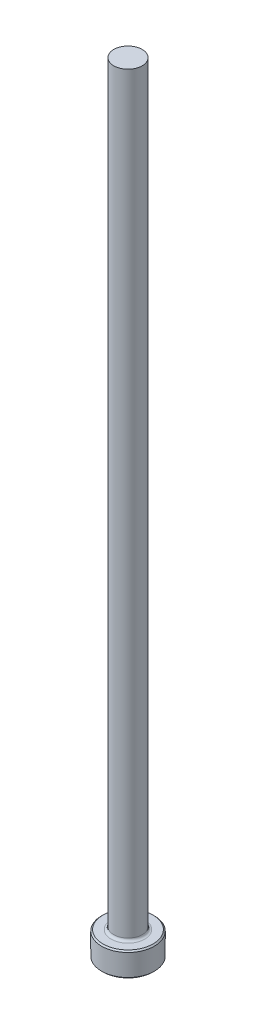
SolidWorks part; units mm, degrees
ref_plane "Front Plane" through (0, 0, 0) normal (0, 0, 1) x (1, 0, 0)
ref_plane "Top Plane" through (0, 0, 0) normal (0, 1, 0) x (1, 0, 0)
ref_plane "Right Plane" through (0, 0, 0) normal (1, 0, 0) x (0, 0, -1)
sketch "Sketch1" plane through (0, 0, 0) normal (0, 0, 1) x (1, 0, 0)
  line L0 (0, 259.9588) -> (0, -15.1925) construction
  line L1 (0, 0) -> (-5.1562, 0)
  line L2 (-5.1562, 0) -> (-5.1562, 4.7498)
  line L3 (-5.1562, 4.7498) -> (-2.7775, 4.7498)
  line L4 (-2.7775, 4.7498) -> (-2.7775, 152.4)
  line L5 (-2.7775, 152.4) -> (0, 152.4)
  line L6 (0, 152.4) -> (0, 0)
  dimension "L" = 152.4
  dimension "H" = 10.3124
  dimension "T" = 4.7498
  dimension "D" = 5.555
revolve "Revolve1" add sketch "Sketch1" angle 360 about L0
chamfer "Chamfer1" distance 0.254 angle 45 2 edges at (0, 4.7498, 5.1562) (0, 0, 5.1562)
fillet "Fillet1" radius 0.508 1 edges at (0, 4.7498, 2.7775)
sketch "Pocket Sketch" plane through (0, 0, 0) normal (0, 0, 1) x (1, 0, 0)
  line L0 (-5.5531, 0) -> (-5.5531, 4.7752)
  line L1 (-5.5531, 4.7752) -> (-3.7379, 4.7752)
  line L2 (-2.9759, 5.5372) -> (-2.9759, 22.225)
  line L3 (-2.9759, 22.225) -> (0, 22.225)
  line L4 (0, 22.225) -> (0, 0)
  line L5 (0, 0) -> (-5.5531, 0)
  line L6 (0, 12.6104) -> (0, -2.4989) construction
  line L7 (-5.1562, 4.4958) -> (-5.1562, 0.254) construction
  line L8 (4.9022, 4.7498) -> (-4.9022, 4.7498) construction
  line L9 (-2.7775, 152.4) -> (-2.7775, 5.2578) construction
  line L10 (-3.7379, 4.7752) -> (-2.9759, 5.5372)
  point P3 (-2.9759, 4.7752)
  dimension "D1" = 11.1061
  dimension "D2" = 0.3969
  dimension "D3" = 0.0254
  dimension "D4" = 0.1984
  dimension "D5" = 5.9519
  dimension "D6" = 22.225
